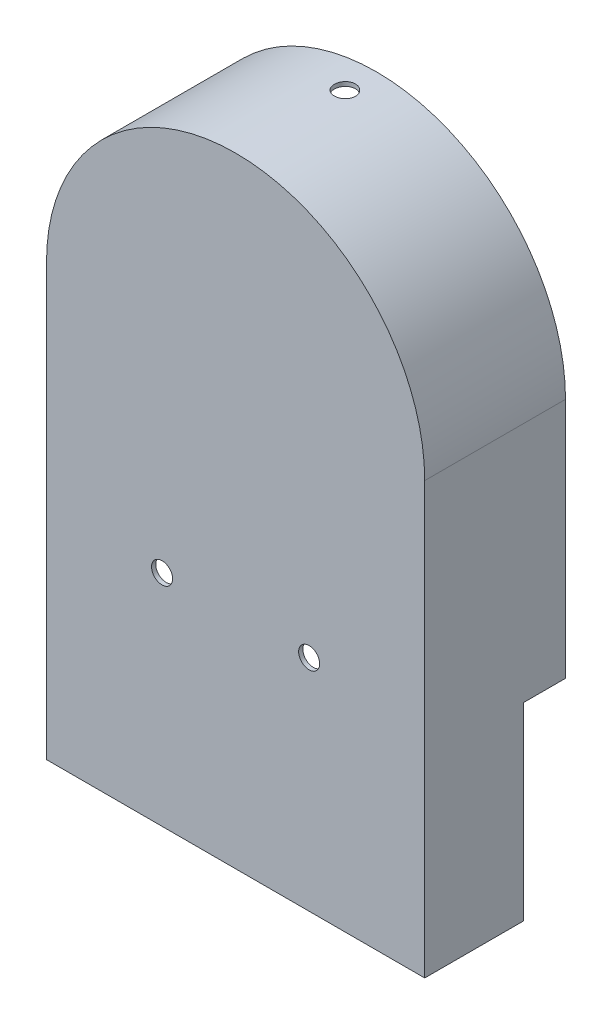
SolidWorks part; units mm, degrees
ref_plane "Plan1" through (0, 0, 0) normal (0, 0, 1) x (1, 0, 0)
ref_plane "Plan2" through (0, 0, 0) normal (0, 1, 0) x (1, 0, 0)
ref_plane "Plan3" through (0, 0, 0) normal (1, 0, 0) x (0, 0, -1)
sketch "Esquisse1" plane through (0, 0, 0) normal (0, 0, 1) x (1, 0, 0)
  line L0 (90, 0) -> (90, -205)
  line L1 (90, -205) -> (-90, -205)
  line L2 (-90, -205) -> (-90, 0)
  arc A0 (90, 0) -> (-90, 0) centre (0, 0) ccw
  dimension "D1" = 180
  dimension "D2" = 205
extrude "Extrusion1" add sketch "Esquisse1" along normal blind 2
sketch "Esquisse2" plane through (0, 0, 0) normal (0, 0, -1) x (-1, 0, 0)
  line L0 (90, -205) -> (90, 0)
  line L1 (90, -205) -> (-90, -205)
  line L2 (-90, -205) -> (-90, 0)
  line L5 (88, -203) -> (88, 0)
  line L6 (-88, -203) -> (-88, 0)
  line L7 (88, -203) -> (-88, -203)
  arc A0 (90, 0) -> (-90, 0) centre (0, 0) ccw
  arc A1 (90, 0) -> (-90, 0) centre (0, 0) ccw construction
  arc A2 (88, 0) -> (-88, 0) centre (0, 0) ccw
  dimension "D1" = 2
extrude "Extrusion2" add sketch "Esquisse2" along normal blind 65
sketch "Esquisse3" plane through (-90, 0, 0) normal (-1, 0, 0) x (0, 0, 1)
  line L1 (-65, -205) -> (-45, -205)
  line L2 (-65, -205) -> (-65, -115)
  line L3 (-65, -115) -> (-45, -115)
  line L4 (-45, -205) -> (-45, -115)
  dimension "D1" = 20
  dimension "D2" = 90
extrude "Enlèv. mat.-Extru.1" cut sketch "Esquisse3" against normal through all
sketch "Esquisse4" plane through (0, 0, 2) normal (0, 0, 1) x (1, 0, 0)
  line L0 (-90, -205) -> (90, -205) construction
  line L1 (-90, 0) -> (-90, -205) construction
  line L3 (35, -100.5) -> (-35, -100.5) construction
  circle A0 centre (35, -100.5) radius 5
  circle A1 centre (-35, -100.5) radius 5
  dimension "D1" = 70
  dimension "D2" = 10
  dimension "D3" = 10
  dimension "D4" = 104.5
  dimension "D5" = 55
extrude "Enlèv. mat.-Extru.2" cut sketch "Esquisse4" against normal through all
sketch "Esquisse5" plane through (0, 0, 0) normal (0, 1, 0) x (1, 0, 0)
  line L0 (-90, -2) -> (90, -2) construction
  circle A0 centre (0, 50) radius 5
  dimension "D1" = 10
  dimension "D2" = 52
extrude "Enlèv. mat.-Extru.4" cut sketch "Esquisse5" along normal through all
